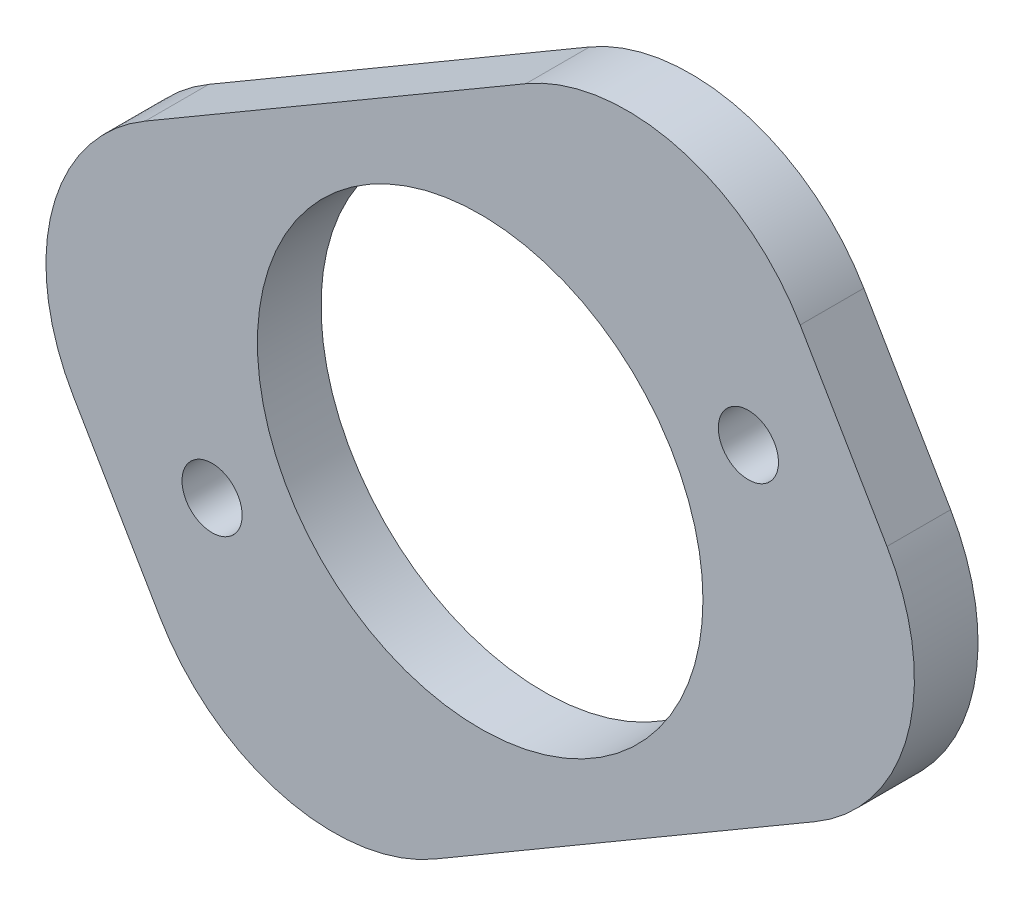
SolidWorks part; units mm, degrees
ref_plane "Front Plane" through (0, 0, 0) normal (0, 0, 1) x (1, 0, 0)
ref_plane "Top Plane" through (0, 0, 0) normal (0, 1, 0) x (1, 0, 0)
ref_plane "Right Plane" through (0, 0, 0) normal (1, 0, 0) x (0, 0, -1)
sketch "Sketch1" plane through (0, 0, 0) normal (0, 0, 1) x (1, 0, 0)
  line L2 (-22.1428, 324.0487) -> (-48.8999, 308.3945) construction
  line L3 (-16.5312, 314.4572) -> (-43.2884, 298.8029) construction
  line L4 (-27.7543, 333.6403) -> (-54.5114, 317.9861) construction
  line L16 (-10.1807, 314.4941) -> (-46.4323, 293.2851)
  line L17 (-10.1807, 314.4941) -> (-24.6104, 339.1581)
  line L18 (-46.4323, 293.2851) -> (-60.862, 317.9492)
  line L19 (-24.6104, 339.1581) -> (-60.862, 317.9492)
  line L20 (-10.1807, 314.4941) -> (-60.862, 317.9492) construction
  line L21 (-46.4323, 293.2851) -> (-24.6104, 339.1581) construction
  line L22 (-10.724, 232.2503) -> (-62.9892, 321.5851) construction
  arc A19 (-25.8542, 321.8773) -> (-45.1884, 310.5659) centre (-35.5213, 316.2216) ccw
  circle A20 centre (-35.5213, 316.2216) radius 11.1125
  arc A21 (-16.5312, 314.4572) -> (-27.7543, 333.6403) centre (-22.1428, 324.0487) ccw construction
  arc A22 (-54.5114, 317.9861) -> (-43.2884, 298.8029) centre (-48.8999, 308.3945) ccw construction
  circle A23 centre (-22.1428, 324.0487) radius 1.5
  circle A24 centre (-48.8945, 308.3853) radius 1.5
  point P33 (-35.5213, 316.2216)
  dimension "D2" = 22.225
  dimension "D3" = 3.175
  dimension "D1" = 3
  dimension "D4" = 3
  dimension "D5" = 11.2
  dimension "D6" = 11.1125
  dimension "D7" = 10.1807
  dimension "D8" = 22.1428
  dimension "D9" = 24.6104
  dimension "D10" = 25.8542
  dimension "D11" = 35.5213
  dimension "D12" = 45.1884
  dimension "D13" = 46.4323
  dimension "D14" = 48.8945
  dimension "D15" = 308.3853
  dimension "D16" = 308.3945
  dimension "D17" = 310.5659
extrude "Boss-Extrude3" add sketch "Sketch1" along normal blind 3.175
fillet "Fillet1" radius 10 4 edges at (-60.862, 317.9492, 1.5875) (-46.4323, 293.2851, 1.5875) (-10.1807, 314.4941, 1.5875) (-24.6104, 339.1581, 1.5875)
